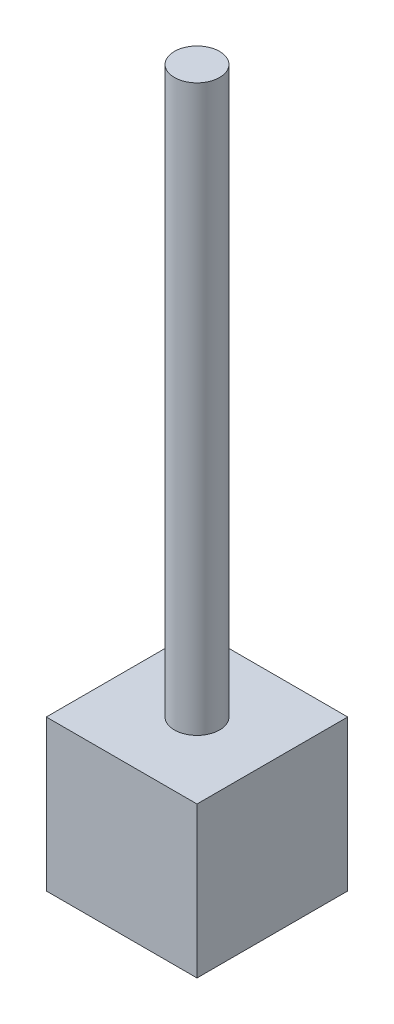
SolidWorks part; units mm, degrees
ref_plane "Face" through (0, 0, 0) normal (0, 0, 1) x (1, 0, 0)
ref_plane "Dessus" through (0, 0, 0) normal (0, 1, 0) x (1, 0, 0)
ref_plane "Droite" through (0, 0, 0) normal (1, 0, 0) x (0, 0, -1)
sketch "Esquisse1" plane through (0, 0, 0) normal (0, 0, 1) x (1, 0, 0)
  line L1 (0, 0) -> (40, 0)
  line L2 (0, 0) -> (0, 40)
  line L3 (0, 40) -> (40, 40)
  line L4 (40, 0) -> (40, 40)
  dimension "D1" = 40
  dimension "D2" = 40
extrude "Extrusion1" add sketch "Esquisse1" along normal blind 40
sketch "Esquisse2" plane through (0, 40, 0) normal (0, 1, 0) x (-1, 0, 0)
  line L0 (0, 40) -> (0, 0) construction
  line L1 (-40, 40) -> (0, 40) construction
  circle A0 centre (-20, 20) radius 6
  dimension "D1" = 12
  dimension "D3" = 20
  dimension "D2" = 20
extrude "Extrusion2" add sketch "Esquisse2" along normal blind 150
